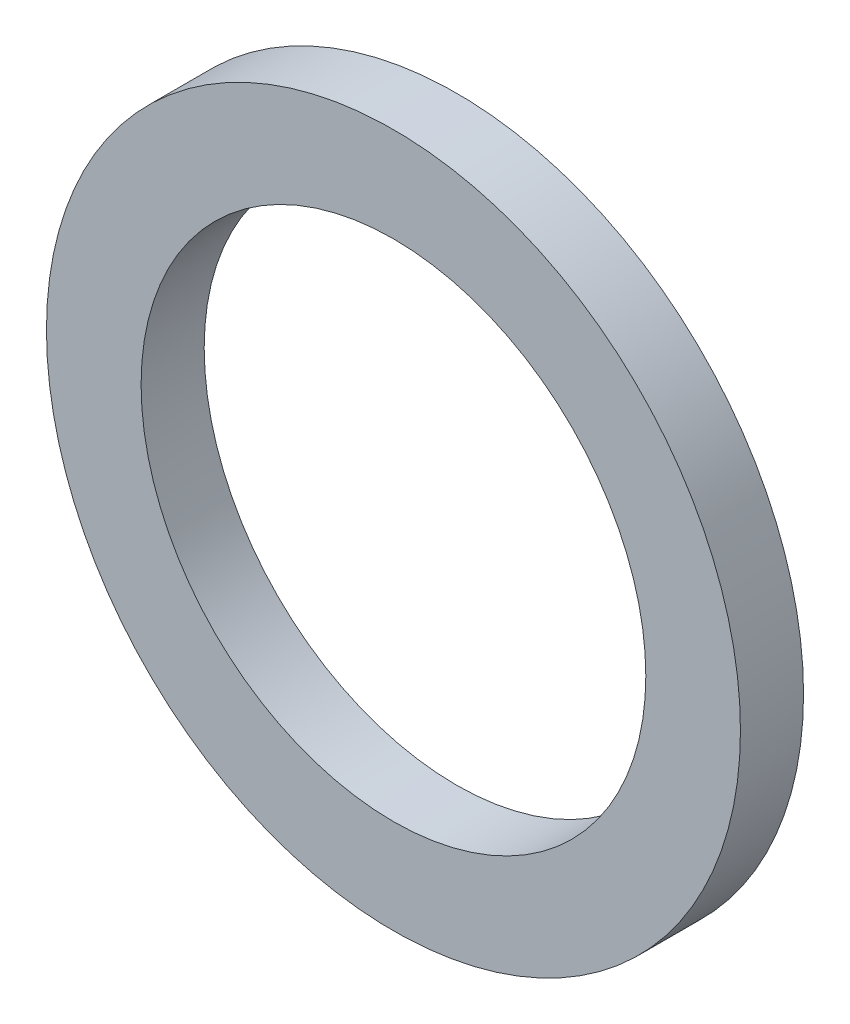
SolidWorks part; units mm, degrees
ref_plane "Front" through (0, 0, 0) normal (0, 0, 1) x (1, 0, 0)
ref_plane "Top" through (0, 0, 0) normal (0, 1, 0) x (1, 0, 0)
ref_plane "Right" through (0, 0, 0) normal (1, 0, 0) x (0, 0, -1)
sketch "Sketch1" plane through (0, 0, 0) normal (0, 0, 1) x (1, 0, 0)
  circle A0 centre (0, 0) radius 20
  circle A1 centre (0, 0) radius 27.5
  dimension "D1" = 55
  dimension "D2" = 40
extrude "Extrude1" add sketch "Sketch1" along normal blind 5
